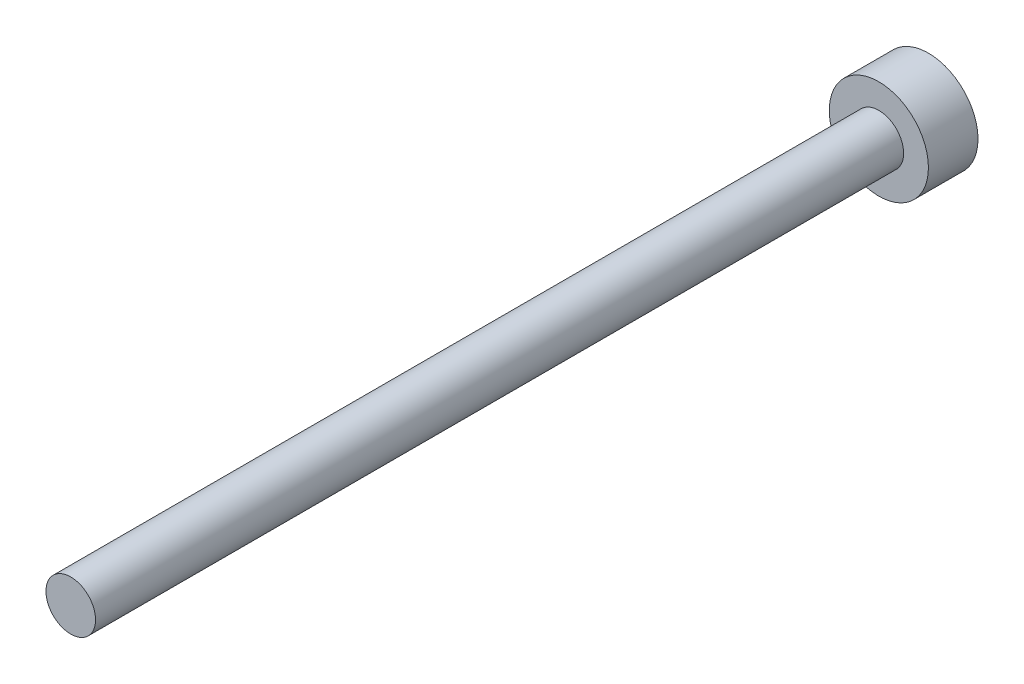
SolidWorks part; units mm, degrees
ref_plane "Plan de face" through (0, 0, 0) normal (0, 0, 1) x (1, 0, 0)
ref_plane "Plan de dessus" through (0, 0, 0) normal (0, 1, 0) x (1, 0, 0)
ref_plane "Plan de droite" through (0, 0, 0) normal (1, 0, 0) x (0, 0, -1)
sketch "Esquisse1" plane through (0, 0, 0) normal (0, 0, 1) x (1, 0, 0)
  circle A0 centre (0, 0) radius 2
  dimension "D1" = 4
extrude "Boss.-Extru.1" add sketch "Esquisse1" along normal blind 2
sketch "Esquisse2" plane through (0, 0, 2) normal (0, 0, 1) x (1, 0, 0)
  circle A0 centre (0, 0) radius 1
  dimension "D1" = 2
extrude "Boss.-Extru.2" add sketch "Esquisse2" along normal blind 32.6
